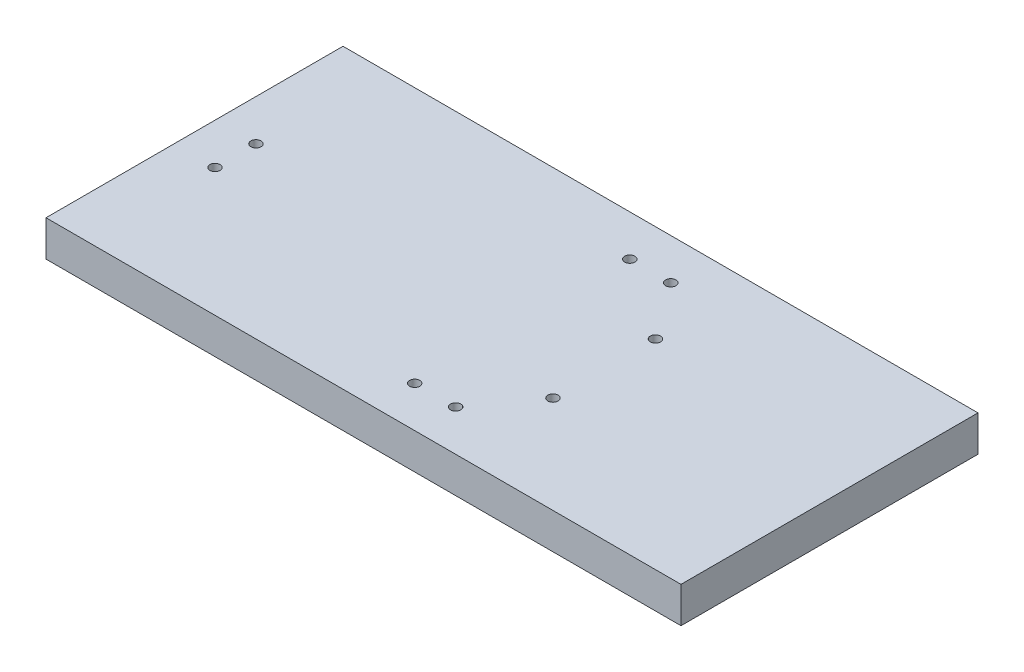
SolidWorks part; units mm, degrees
ref_plane "Front Plane" through (0, 0, 0) normal (0, 0, 1) x (1, 0, 0)
ref_plane "Top Plane" through (0, 0, 0) normal (0, 1, 0) x (1, 0, 0)
ref_plane "Right Plane" through (0, 0, 0) normal (1, 0, 0) x (0, 0, -1)
sketch "Sketch1" plane through (0, 0, 0) normal (0, 1, 0) x (1, 0, 0)
  line L0 (-43.732, -14.9008) -> (66.2802, -14.9008) construction
  line L1 (-39.2227, 8.1179) -> (59.2023, 8.1179)
  line L2 (-39.2227, 8.1179) -> (-39.2227, -37.9196)
  line L3 (-39.2227, -37.9196) -> (59.2023, -37.9196)
  line L4 (59.2023, 8.1179) -> (59.2023, -37.9196)
  circle A0 centre (11.5773, -31.5696) radius 0.7937
  circle A1 centre (17.9273, -31.5696) radius 0.7937
  circle A2 centre (11.5773, 1.7679) radius 0.7937
  circle A3 centre (17.9273, 1.7679) radius 0.7937
  circle A4 centre (-32.8727, -11.7258) radius 0.7937
  circle A5 centre (24.2773, -22.8383) radius 0.7937
  circle A6 centre (24.2773, -6.9633) radius 0.7937
  circle A7 centre (-32.8727, -18.0758) radius 0.7937
  dimension "D3" = 1.5875
  dimension "D4" = 50.8
  dimension "D5" = 6.35
  dimension "D6" = 57.15
  dimension "D7" = 6.35
  dimension "D8" = 50.8
  dimension "D9" = 6.35
  dimension "D10" = 57.15
  dimension "D11" = 6.35
  dimension "D12" = 1.5875
  dimension "D13" = 3.175
  dimension "D14" = 1.5875
  dimension "D15" = 7.9375
  dimension "D16" = 6.35
  dimension "D17" = 63.5
  dimension "D1" = 46.0375
  dimension "D2" = 98.425
  dimension "D18" = 23.0188
extrude "Extrude1" add sketch "Sketch1" along normal blind 5.5562
